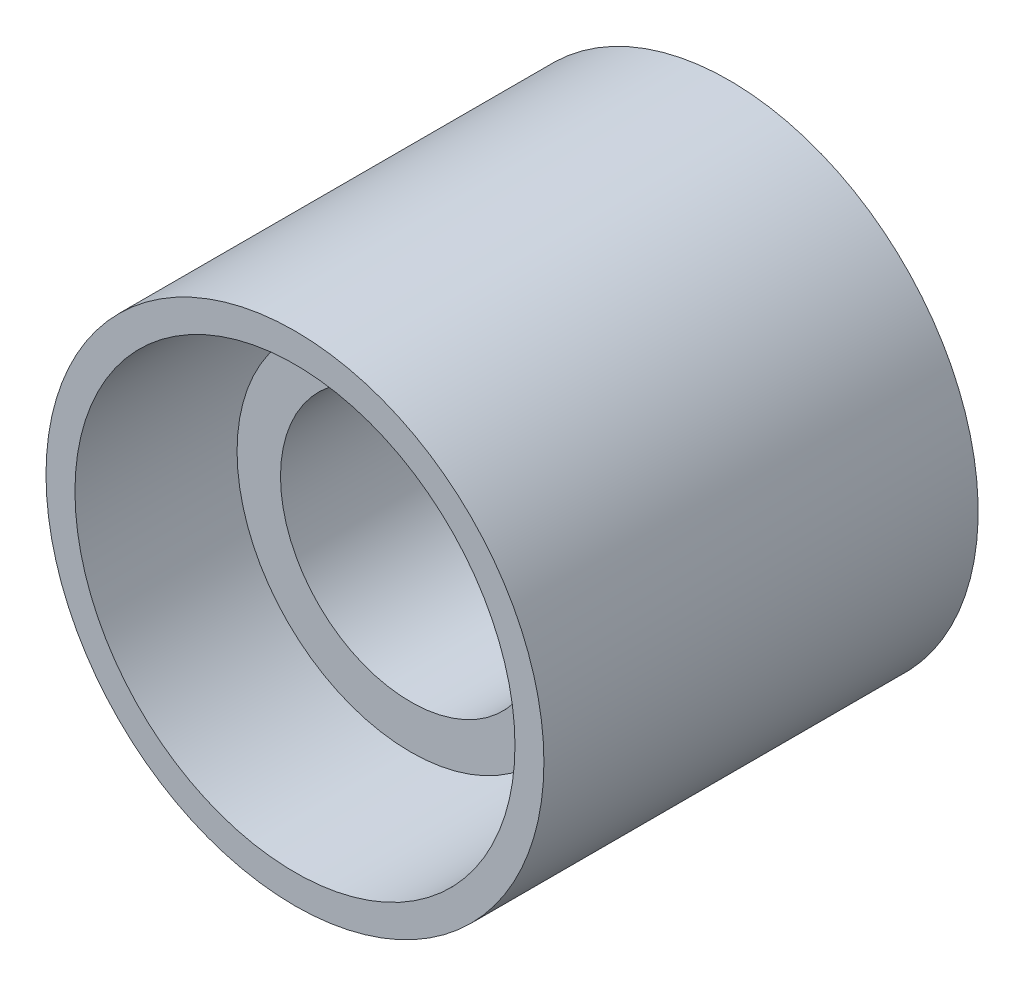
SolidWorks part; units mm, degrees
ref_plane "前视基准面" through (0, 0, 0) normal (0, 0, 1) x (1, 0, 0)
ref_plane "上视基准面" through (0, 0, 0) normal (0, 1, 0) x (1, 0, 0)
ref_plane "右视基准面" through (0, 0, 0) normal (1, 0, 0) x (0, 0, -1)
sketch "草图1" plane through (0, 0, 0) normal (0, 0, 1) x (1, 0, 0)
  circle A0 centre (0, 0) radius 43
  circle A1 centre (0, 0) radius 38
  dimension "D1" = 86
  dimension "D2" = 76
extrude "拉伸1" add sketch "草图1" along normal blind 40
sketch "草图2" plane through (0, 0, 0) normal (0, 0, -1) x (-1, 0, 0)
  circle A0 centre (0, 0) radius 30
  dimension "D1" = 60
extrude "拉伸2" add sketch "草图2" against normal blind 20
sketch "草图3" plane through (0, 0, 0) normal (0, 0, -1) x (-1, 0, 0)
  circle A0 centre (0, 0) radius 43
  dimension "D1" = 86
extrude "拉伸3" add sketch "草图3" along normal blind 35
sketch "草图4" plane through (0, 0, -35) normal (0, 0, -1) x (-1, 0, 0)
  circle A0 centre (0, 0) radius 22.5
  dimension "D1" = 45
extrude "切除-拉伸1" cut sketch "草图4" against normal through all
